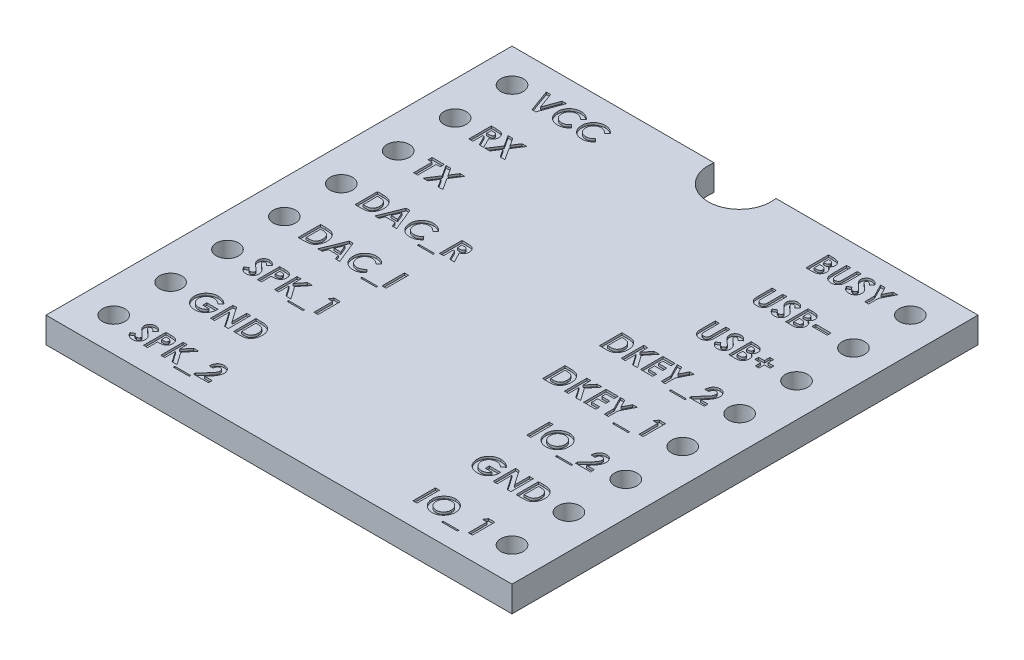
SolidWorks part; units mm, degrees
ref_plane "Front Plane" through (0, 0, 0) normal (0, 0, 1) x (1, 0, 0)
ref_plane "Top Plane" through (0, 0, 0) normal (0, 1, 0) x (1, 0, 0)
ref_plane "Right Plane" through (0, 0, 0) normal (1, 0, 0) x (0, 0, -1)
sketch "Sketch1" plane through (0, 0, 0) normal (0, 1, 0) x (1, 0, 0)
  line L1 (-8.89, -8.89) -> (8.89, -8.89) construction
  line L2 (-8.89, -8.89) -> (-8.89, 8.89) construction
  line L3 (-8.89, 8.89) -> (8.89, 8.89) construction
  line L4 (8.89, -8.89) -> (8.89, 8.89) construction
  line L5 (-8.89, -8.89) -> (8.89, 8.89) construction
  line L6 (-8.89, 8.89) -> (8.89, -8.89) construction
  line L7 (-10.4, 10.4) -> (10.4, 10.4)
  line L8 (-10.4, 10.4) -> (-10.4, -10.4)
  line L9 (-10.4, -10.4) -> (10.4, -10.4)
  line L10 (10.4, 10.4) -> (10.4, -10.4)
  line L11 (-10.4, 10.4) -> (10.4, -10.4) construction
  line L12 (-10.4, -10.4) -> (10.4, 10.4) construction
  circle A0 centre (-8.89, -8.89) radius 0.4
  circle A1 centre (8.89, -8.89) radius 0.4
  point P0 (0, 0)
  point P5 (0, 0)
  dimension "D3" = 0.8
  dimension "D4" = 0.8
  dimension "D1" = 17.78
  dimension "D2" = 20.8
extrude "Boss-Extrude1" add sketch "Sketch1" along normal blind 1.15
hole_wizard "Ø1.0 (1) Diameter Hole2" positions "Sketch4" profile "Sketch5" hole size "Ø1.0" standard "ANSI Metric"
sketch "Sketch4" plane through (0, 1.15, 0) normal (0, 1, 0) x (1, 0, 0)
  point P0 (-8.89, -8.89)
  point P3 (8.89, -8.89)
  point P10 (-8.89, -6.35)
  point P11 (8.89, -6.35)
  point P12 (-8.89, -3.81)
  point P13 (8.89, -3.81)
  point P14 (-8.89, -1.27)
  point P15 (8.89, -1.27)
  point P16 (-8.89, 1.27)
  point P17 (8.89, 1.27)
  point P18 (-8.89, 3.81)
  point P19 (8.89, 3.81)
  point P20 (-8.89, 6.35)
  point P21 (8.89, 6.35)
  point P22 (-8.89, 8.89)
  point P23 (8.89, 8.89)
  dimension "D1" = 8
sketch "Sketch5" plane through (-8.89, 1.15, 8.89) normal (1, 0, 0) x (0, 0, 1)
  line L0 (0, 0) -> (0, 1.15)
  line L1 (0, 1.15) -> (0.5, 1.15)
  line L2 (0.5, 1.15) -> (0.5, 0)
  line L5 (0.5, 0) -> (0, 0)
  line L11 (0, -6.35) -> (0, 107.95) construction
  dimension "Thru Hole Dia." = 1
  dimension "Thru Hole Depth" = 1.15
sketch "Sketch6" plane through (0, 1.15, 0) normal (0, 1, 0) x (1, 0, 0)
  line L0 (0, 10.4) -> (0, 10.16) construction
  line L1 (10.4, 10.4) -> (-10.4, 10.4) construction
  circle A0 centre (0, 10.16) radius 1.4
  dimension "D1" = 0.24
  dimension "D2" = 2.8
extrude "Cut-Extrude1" cut sketch "Sketch6" against normal blind 10
sketch "Sketch7" plane through (0, 1.15, 0) normal (0, 1, 0) x (1, 0, 0)
  line L1 (-7.89, 8.39) -> (-3.3136, 8.39) construction
  line L2 (2.1529, 8.39) -> (7.89, 8.39) construction
  circle A0 centre (-8.89, 8.89) radius 0.5 construction
  circle A1 centre (8.89, 8.89) radius 0.5 construction
  text T0 "VCC  RX  TX  DAC_R  DAC_I  SPK_1  GND  SPK_2" font "Century Gothic" height 1
  text T1 "BUSY  USB−  USB+  ADKEY_2  ADKEY_1  IO_2  GND  IO_1" font "Century Gothic" height 1
  point P10 (2.1529, 8.39)
  dimension "D1" = 1
  dimension "D2" = 0.5
  dimension "D3" = 1
extrude "Cut-Extrude2" cut sketch "Sketch7" against normal blind 0.1
